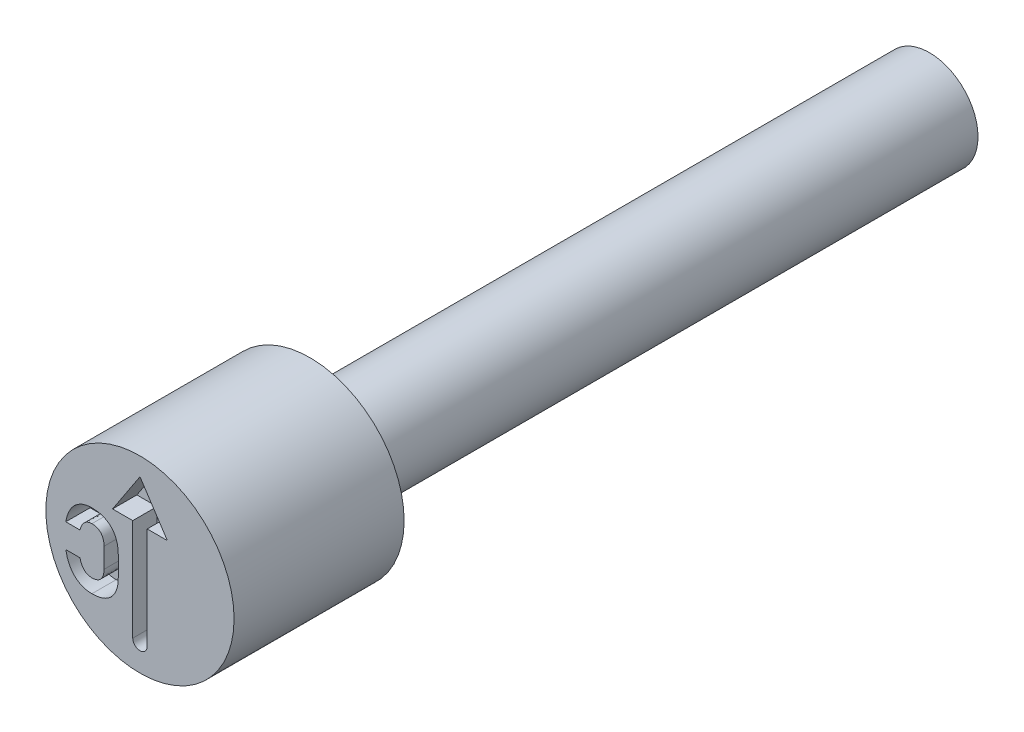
SolidWorks part; units mm, degrees
ref_plane "Front Plane" through (0, 0, 0) normal (0, 0, 1) x (1, 0, 0)
ref_plane "Top Plane" through (0, 0, 0) normal (0, 1, 0) x (1, 0, 0)
ref_plane "Right Plane" through (0, 0, 0) normal (1, 0, 0) x (0, 0, -1)
sketch "Sketch2" plane through (0, 0, 0) normal (1, 0, 0) x (0, 0, -1)
  line L0 (0.4039, 0) -> (50000.4039, 0) construction
  line L6 (0, 1.55) -> (0, 0)
  line L7 (2.8, 1.55) -> (0, 1.55)
  line L8 (2.8, 0.8) -> (2.8, 1.55)
  line L9 (13, 0.8) -> (2.8, 0.8)
  line L10 (13, 0) -> (13, 0.8)
  line L11 (0, 0) -> (13, 0)
  dimension "D1" = 3.1
  dimension "D2" = 1.6
  dimension "D3" = 13
  dimension "D4" = 2.8
revolve "Revolve1" add sketch "Sketch2" angle 360 about L0
sketch "Sketch3" plane through (0, 0, 0) normal (0, 0, 1) x (1, 0, 0)
  line L0 (0, 0) -> (0, 62500) construction
  line L1 (0.119, 0.5665) -> (0.119, -1.1101)
  line L2 (0.4512, 0.5665) -> (0.119, 0.5665)
  line L3 (0, 1.2513) -> (0.4512, 0.5665)
  line L15 (0, 1.2513) -> (-0.4512, 0.5665)
  line L16 (-0.4512, 0.5665) -> (-0.119, 0.5665)
  line L17 (-0.119, 0.5665) -> (-0.119, -1.1101)
  arc A2 (-0.119, -1.1101) -> (0.119, -1.1101) centre (0, -1.1101) ccw
extrude "Cut-Extrude4" cut sketch "Sketch3" against normal blind 0.4
sketch "Sketch4" plane through (0, 0, 0) normal (0, 0, 1) x (1, 0, 0)
  text T0 "C" font "Bahnschrift" height 1.2
  dimension "D1" = 0.8
  dimension "D2" = 0.25
extrude "Cut-Extrude5" cut sketch "Sketch4" against normal blind 0.4
